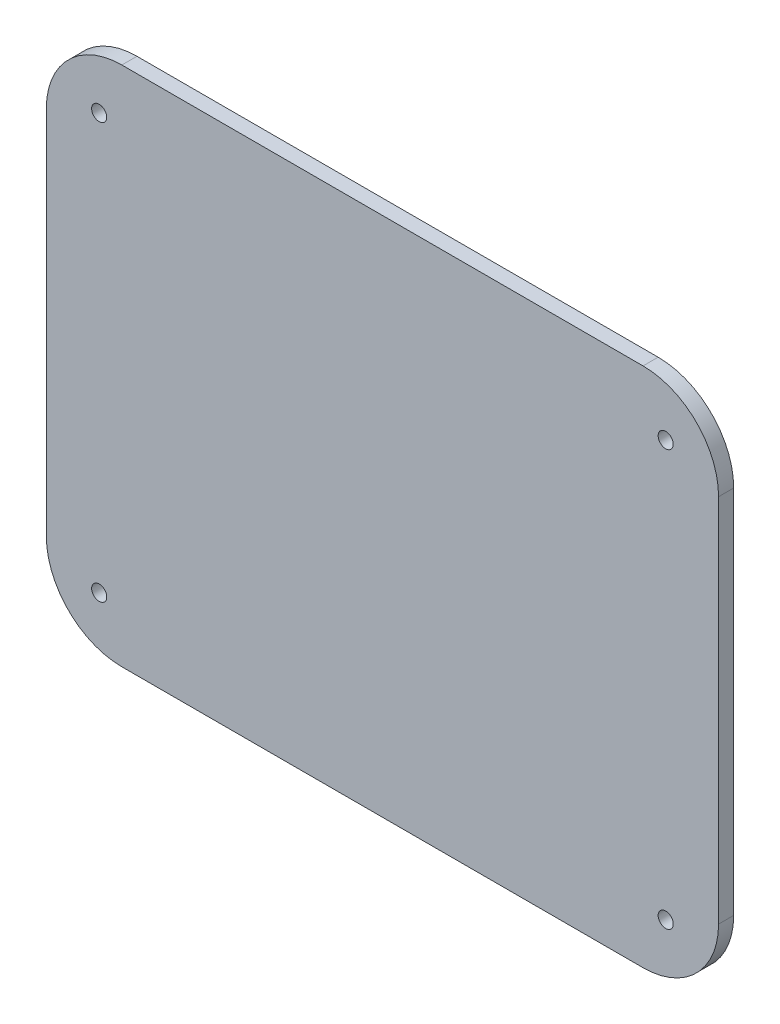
SolidWorks part; units mm, degrees
ref_plane "前视基准面" through (0, 0, 0) normal (0, 0, 1) x (1, 0, 0)
ref_plane "上视基准面" through (0, 0, 0) normal (0, 1, 0) x (1, 0, 0)
ref_plane "右视基准面" through (0, 0, 0) normal (1, 0, 0) x (0, 0, -1)
sketch "草图1" plane through (0, 0, 0) normal (0, 0, 1) x (1, 0, 0)
  line L0 (10, 0) -> (10, -10)
  line L1 (10, 0) -> (79, 0)
  line L2 (0, -10) -> (0, -59)
  line L3 (10, -69) -> (79, -69)
  line L4 (89, -10) -> (89, -59)
  line L5 (10, -10) -> (0, -10)
  line L6 (44.5, 0) -> (44.5, -69) construction
  line L7 (0, -34.5) -> (89, -34.5)
  line L8 (79, -10) -> (89, -10)
  line L9 (79, 0) -> (79, -10)
  line L10 (79, -59) -> (89, -59)
  line L11 (79, -69) -> (79, -59)
  line L12 (10, -59) -> (0, -59)
  line L13 (10, -69) -> (10, -59)
  arc A0 (79, 0) -> (89, -10) centre (79, -10) cw
  arc A1 (0, -59) -> (10, -69) centre (10, -59) ccw
  arc A2 (79, -69) -> (89, -59) centre (79, -59) ccw
  arc A3 (10, 0) -> (0, -10) centre (10, -10) ccw
  circle A4 centre (7, -7) radius 1
  circle A5 centre (82, -7) radius 1
  circle A6 centre (82, -62) radius 1
  circle A7 centre (7, -62) radius 1
  point P7 (89, 0)
  point P10 (0, -69)
  point P15 (0, 0)
  dimension "D3" = 10
  dimension "D5" = 3
  dimension "D6" = 2
  dimension "D1" = 89
  dimension "D2" = 69
  dimension "D4" = 3
extrude "凸台-拉伸1" add sketch "草图1" against normal blind 2 contours L6 L1 L0 L5 L2 L7 | L1 L6 L7 L4 L8 L9 | L6 L7 L2 L12 L13 L3 | L7 L6 L3 L11 L10 L4 | L0 A3 L5 A4 | A0 L9 L8 A5 | L12 A1 L13 A7 | L11 A2 L10 A6
